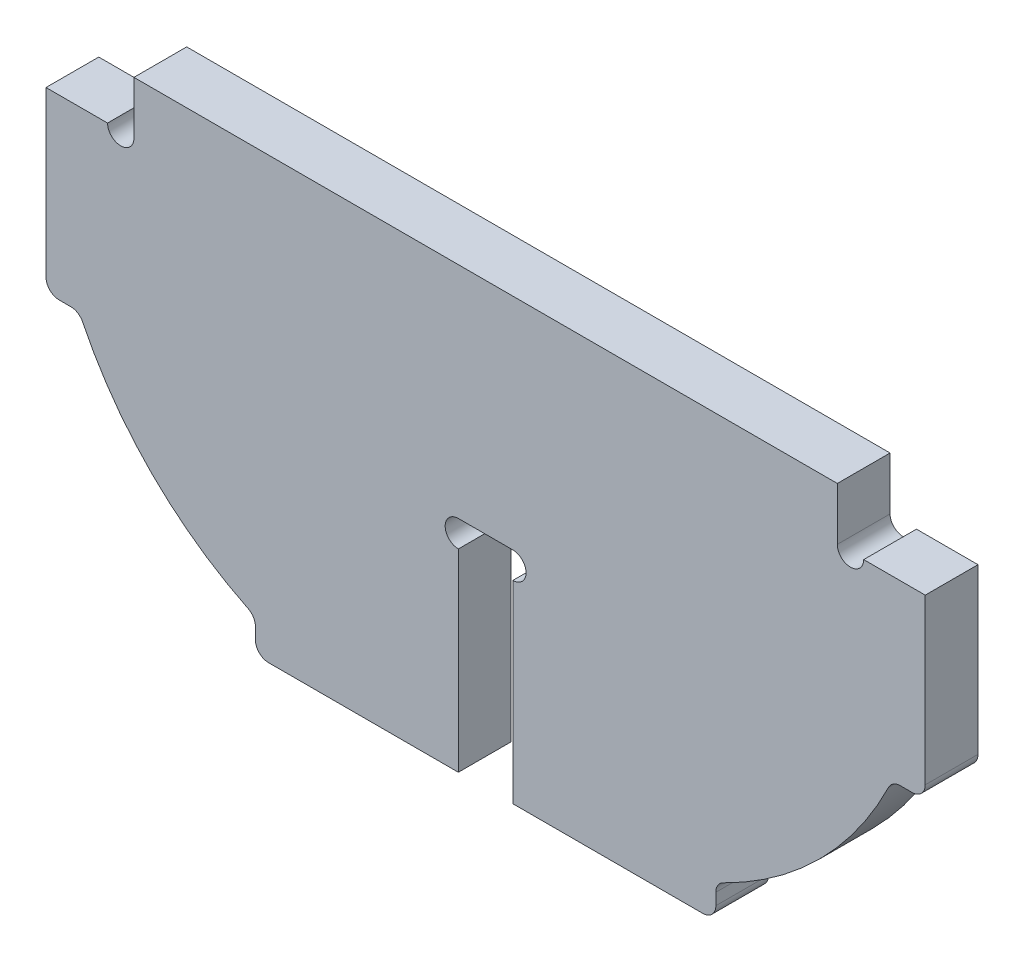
SolidWorks part; units mm, degrees
ref_plane "Front Plane" through (0, 0, 0) normal (0, 0, 1) x (1, 0, 0)
ref_plane "Top Plane" through (0, 0, 0) normal (0, 1, 0) x (1, 0, 0)
ref_plane "Right Plane" through (0, 0, 0) normal (1, 0, 0) x (0, 0, -1)
sketch "Crossbrace_Profile" plane through (0, 0, 0) normal (0, 0, 1) x (1, 0, 0)
  line L0 (-100, 50) -> (100, -50) construction
  line L1 (-80, 50) -> (80, 50)
  line L2 (-100, 38) -> (-100, -50)
  line L3 (-100, -50) -> (100, -50)
  line L4 (100, 38) -> (100, -50)
  line L5 (-100, 38) -> (-86, 38)
  line L6 (-80, 38) -> (-80, 50)
  line L7 (80, 50) -> (80, 38)
  line L8 (86, 38) -> (100, 38)
  arc A0 (-86, 38) -> (-80, 38) centre (-83, 38) ccw
  arc A1 (80, 38) -> (86, 38) centre (83, 38) ccw
  dimension "Dogbone_Diameter" = 6
  dimension "Crossbrace_Length" = 100
  dimension "Crossbrace_Width" = 200
  dimension "Shoulder_Width" = 20
  dimension "Shoulder_Depth" = 12
extrude "Crossbrace_Extrude" add sketch "Crossbrace_Profile" along normal blind 12
sketch "Slot" plane through (0, 0, 0) normal (0, 0, 1) x (1, 0, 0)
  line L0 (-100, -50) -> (100, -50) construction
  line L1 (6.2, -50) -> (-6.2, -50)
  line L2 (6.2, -50) -> (6.2, -6)
  line L3 (6.2, 0) -> (-6.2, 0)
  line L4 (-6.2, -50) -> (-6.2, -6)
  arc A0 (-6.2, 0) -> (-6.2, -6) centre (-6.2, -3) ccw
  arc A1 (-86, 38) -> (-80, 38) centre (-83, 38) ccw construction
  arc A2 (6.2, -6) -> (6.2, 0) centre (6.2, -3) ccw
  point P4 (0, -50)
  dimension "Slot_Length" = 50
  dimension "Slot_Thickness" = 12.4
extrude "Cut-Extrude2" cut sketch "Slot" along normal through all
sketch "Sketch4" plane through (0, 0, 0) normal (0, 0, 1) x (1, 0, 0)
  line L2 (80, 50) -> (80, 38) construction
  line L3 (6.2, -50) -> (18.2, -50) construction
  line L4 (-100, -50) -> (100, -50) construction
  line L6 (100, -50) -> (49.3688, -50)
  line L7 (97, -2.3688) -> (94.3451, -2.3688)
  line L8 (52.3688, -47) -> (52.3688, -44.3451)
  line L9 (100, 0.6312) -> (100, -50)
  arc A1 (97, -2.3688) -> (100, 0.6312) centre (97, 0.6312) ccw
  arc A2 (80, 38) -> (86, 38) centre (83, 38) ccw construction
  arc A3 (94.3451, -2.3688) -> (91.6506, -4.0499) centre (94.3451, -5.3688) ccw
  arc A4 (49.3688, -50) -> (52.3688, -47) centre (49.3688, -47) ccw
  arc A5 (54.0499, -41.6506) -> (52.3688, -44.3451) centre (55.3688, -44.3451) ccw
  arc A6 (54.0499, -41.6506) -> (91.6506, -4.0499) centre (18, 32) ccw
extrude "Cut-Extrude3" cut sketch "Sketch4" along normal through all
mirror "Mirror1" about plane through (0, 0, 0) normal (1, 0, 0) of "Cut-Extrude3"
equation "\"Crossbrace_Length@Crossbrace_Profile\"= \"crossbrace_length@Table.SLDASM\""
equation "\"Crossbrace_Width@Crossbrace_Profile\"= \"crossbrace_width@Table.SLDASM\""
equation "\"Dogbone_Diameter@Crossbrace_Profile\"=\"cutter_diameter@Table.SLDASM\""
equation "\"Shoulder_Depth@Crossbrace_Profile\"= \"material_thickness@Table.SLDASM\""
equation "\"Shoulder_Width@Crossbrace_Profile\"= \"leg_shoulder@Table.SLDASM\""
equation "\"D1@Crossbrace_Extrude\"= \"material_thickness@Table.SLDASM\""
equation "\"Slot_Thickness@Slot\"= \"material_thickness@Table.SLDASM\" - ( 2 * \"interference@Table.SLDASM\" )"
equation "\"Slot_Length@Slot\"= \"crossbrace_length@Table.SLDASM\" / 2"
